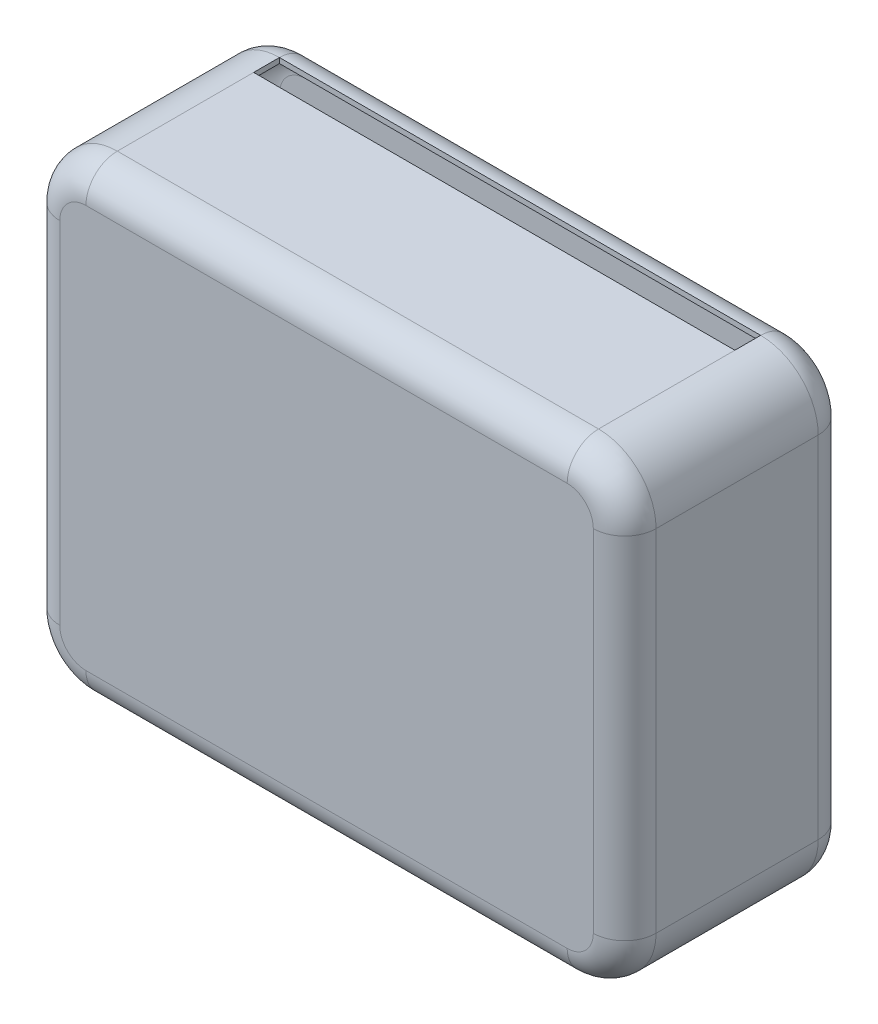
SolidWorks part; units mm, degrees
ref_plane "Front" through (0, 0, 0) normal (0, 0, 1) x (1, 0, 0)
ref_plane "Top" through (0, 0, 0) normal (0, 1, 0) x (1, 0, 0)
ref_plane "Right" through (0, 0, 0) normal (1, 0, 0) x (0, 0, -1)
sketch "Sketch1" plane through (0, 0, 0) normal (0, 0, 1) x (1, 0, 0)
  line L1 (0, 0) -> (-112, 0)
  line L2 (0, 0) -> (0, -87)
  line L3 (0, -87) -> (-112, -87)
  line L4 (-112, 0) -> (-112, -87)
  dimension "D1" = 112
  dimension "D2" = 87
extrude "Boss-Extrude1" add sketch "Sketch1" along normal blind 41
fillet "Fillet3" radius 10 4 edges at (0, 0, 20.5) (-112, 0, 20.5) (0, -87, 20.5) (-112, -87, 20.5)
fillet "Fillet4" radius 5 16 edges at (-112, -43.5, 0) (-109.0711, -84.0711, 0) (-56, -87, 0) (-2.9289, -84.0711, 0) (0, -43.5, 0) (-2.9289, -2.9289, 0) (-56, 0, 0) (-56, 0, 41) (-2.9289, -2.9289, 41) (0, -43.5, 41) (-2.9289, -84.0711, 41) (-56, -87, 41) (-109.0711, -84.0711, 41) (-112, -43.5, 41) (-109.0711, -2.9289, 0) (-109.0711, -2.9289, 41)
shell "Shell2" thickness 1
sketch "Sketch2" plane through (0, 1, 0) normal (0, 1, 0) x (1, 0, 0)
  line L0 (-102, -5) -> (-102, -36) construction
  line L1 (-10, -5) -> (-102, -5)
  line L2 (-10, -5) -> (-10, -9.9365)
  line L3 (-10, -9.9365) -> (-102, -9.9365)
  line L4 (-102, -5) -> (-102, -9.9365)
extrude "Cut-Extrude1" cut sketch "Sketch2" against normal blind 10
